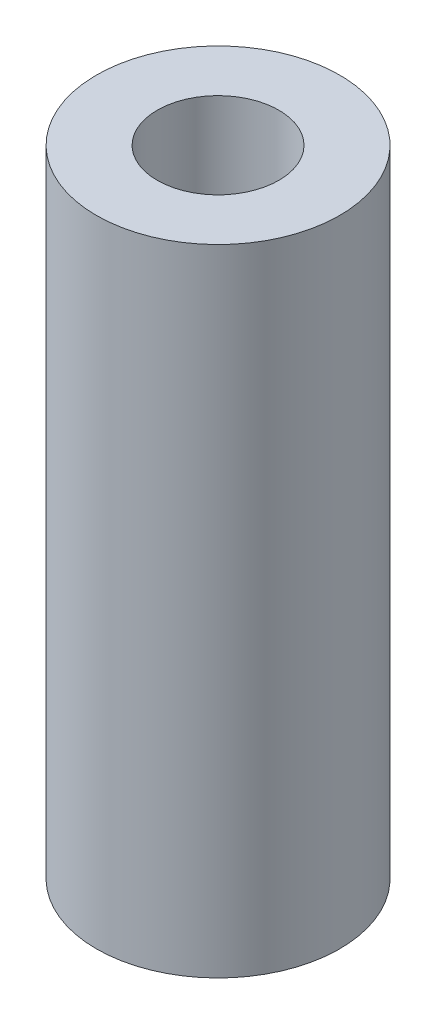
SolidWorks part; units mm, degrees
ref_plane "Front Plane" through (0, 0, 0) normal (0, 0, 1) x (1, 0, 0)
ref_plane "Top Plane" through (0, 0, 0) normal (0, 1, 0) x (1, 0, 0)
ref_plane "Right Plane" through (0, 0, 0) normal (1, 0, 0) x (0, 0, -1)
sketch "Sketch1" plane through (0, 0, 0) normal (0, 1, 0) x (1, 0, 0)
  circle A0 centre (0, 0) radius 7.9375
  circle A1 centre (0, 0) radius 15.875
  dimension "D1" = 15.875
  dimension "D2" = 31.75
extrude "Boss-Extrude1" add sketch "Sketch1" along normal mid plane 82.9056
